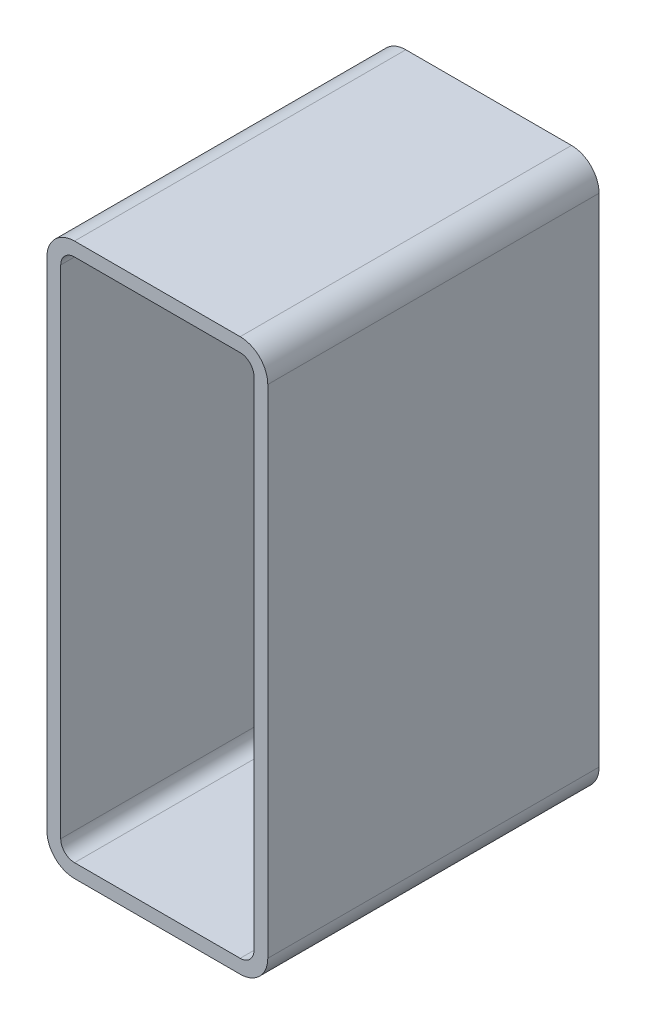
SolidWorks part; units mm, degrees
ref_plane "Front Plane" through (0, 0, 0) normal (0, 0, 1) x (1, 0, 0)
ref_plane "Top Plane" through (0, 0, 0) normal (0, 1, 0) x (1, 0, 0)
ref_plane "Right Plane" through (0, 0, 0) normal (1, 0, 0) x (0, 0, -1)
sketch "Sketch1" plane through (0, 0, 0) normal (0, 0, 1) x (1, 0, 0)
  point P0 (0, 0)
sketch_block_instance "HSS20x8x0.500-1"
sketch_block "HSS20x8x0.500"
extrude "Boss-Extrude1" add sketch "Sketch1" along normal blind 304.8
